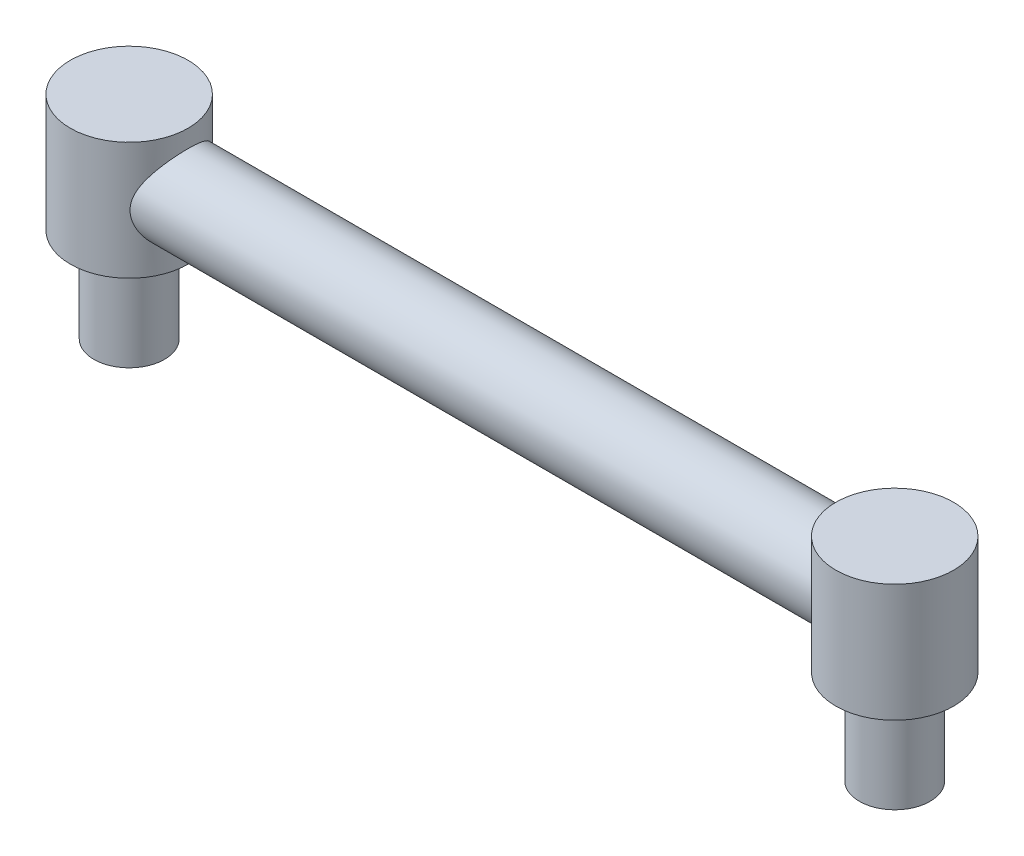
SolidWorks part; units mm, degrees
ref_plane "Alzado" through (0, 0, 0) normal (0, 0, 1) x (1, 0, 0)
ref_plane "Planta" through (0, 0, 0) normal (0, 1, 0) x (1, 0, 0)
ref_plane "Vista lateral" through (0, 0, 0) normal (1, 0, 0) x (0, 0, -1)
sketch "Croquis3" plane through (0, 0, 0) normal (1, 0, 0) x (0, 0, -1)
  circle A0 centre (0, 0) radius 3.5
  dimension "D1" = 7
extrude "Saliente-Extruir1" add sketch "Croquis3" along normal blind 65
sketch "Croquis4" plane through (0, 0, 0) normal (0, 1, 0) x (1, 0, 0)
  line L0 (65, -3.5) -> (65, 3.5) construction
  circle A0 centre (65, 0) radius 5
  circle A1 centre (0, 0) radius 5
  dimension "D1" = 10
  dimension "D2" = 10
extrude "Saliente-Extruir2" add sketch "Croquis4" along normal mid plane 10
sketch "Croquis5" plane through (0, -5, 0) normal (0, -1, 0) x (1, 0, 0)
  circle A0 centre (65, 0) radius 3
  circle A1 centre (0, 0) radius 3
  dimension "D1" = 6
  dimension "D2" = 6
extrude "Saliente-Extruir3" add sketch "Croquis5" along normal blind 8
